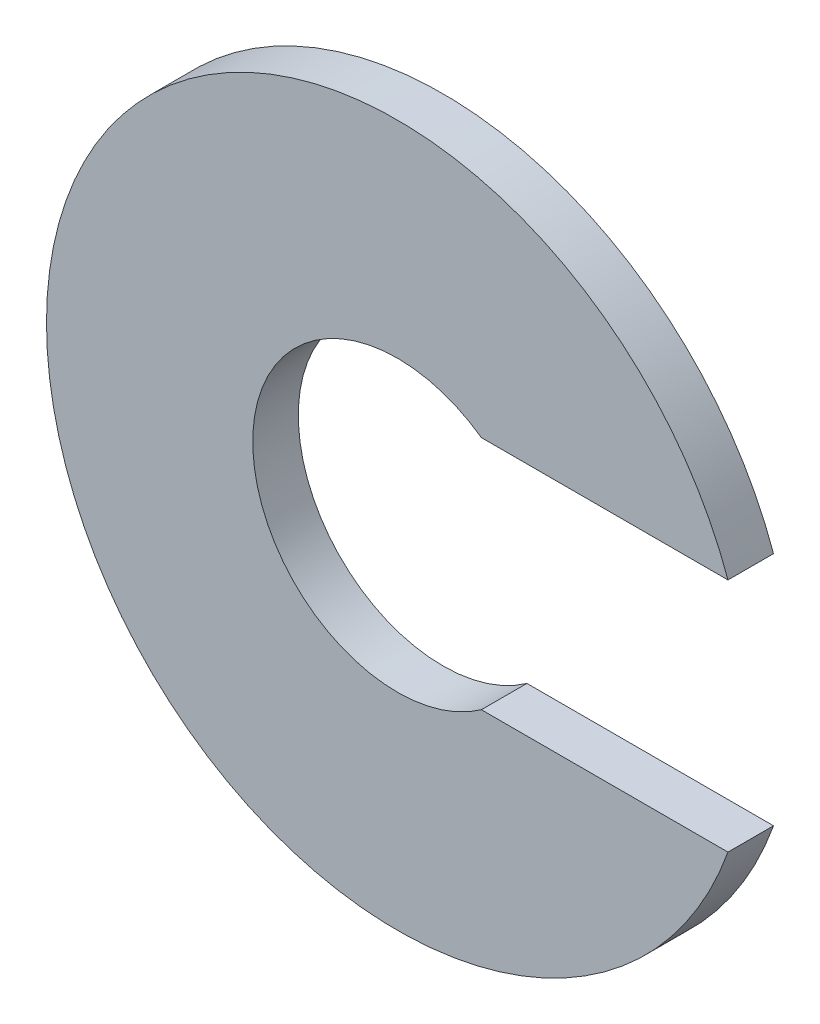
SolidWorks part; units mm, degrees
ref_plane "Plane1" through (0, 0, 0) normal (0, 0, 1) x (1, 0, 0)
ref_plane "Plane2" through (0, 0, 0) normal (0, 1, 0) x (1, 0, 0)
ref_plane "Plane3" through (0, 0, 0) normal (1, 0, 0) x (0, 0, -1)
sketch "Sketch1" plane through (0, 0, 0) normal (0, 0, 1) x (1, 0, 0)
  line L0 (0, 0) -> (10.06, 0) construction
  line L1 (1.3638, 1.9138) -> (5.3691, 1.9138)
  line L2 (1.3638, -1.9138) -> (5.3691, -1.9138)
  arc A0 (5.3691, 1.9138) -> (5.3691, -1.9138) centre (0, 0) ccw
  arc A1 (1.3638, 1.9138) -> (1.3638, -1.9138) centre (0, 0) ccw
  arc A2 (9.1413, -4.2) -> (9.2011, 4.0674) centre (0, 0) ccw construction
extrude "Base-Extrude" add sketch "Sketch1" along normal up to surface (0.74 mm away)
